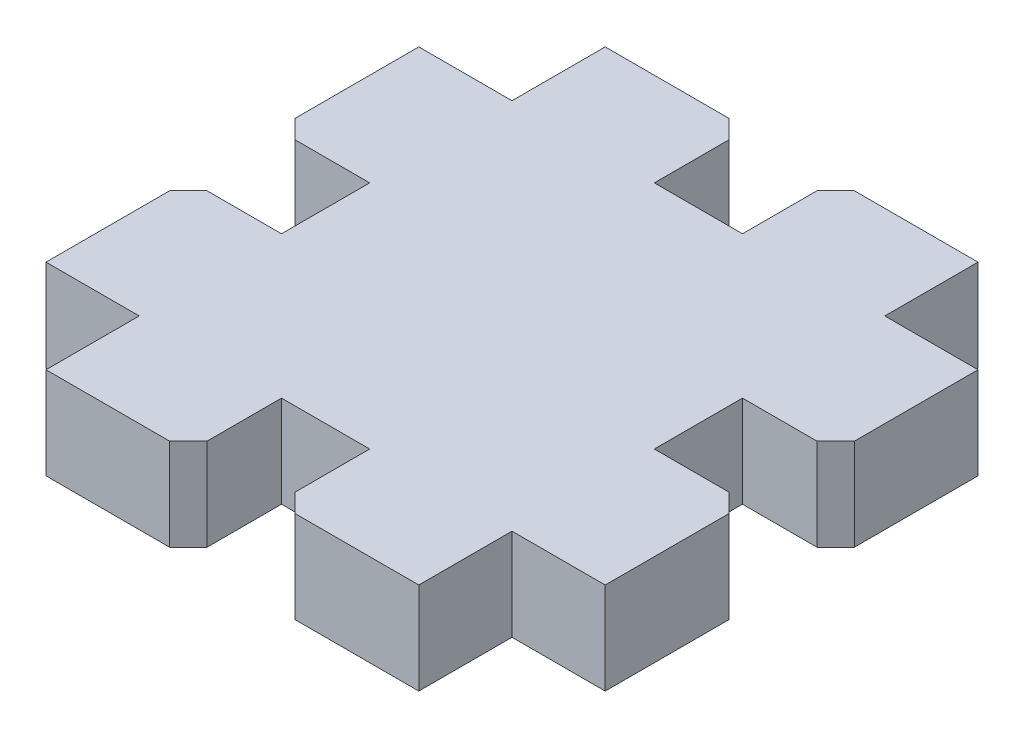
SolidWorks part; units mm, degrees
ref_plane "Front Plane" through (0, 0, 0) normal (0, 0, 1) x (1, 0, 0)
ref_plane "Top Plane" through (0, 0, 0) normal (0, 1, 0) x (1, 0, 0)
ref_plane "Right Plane" through (0, 0, 0) normal (1, 0, 0) x (0, 0, -1)
sketch "Sketch1" plane through (0, 0, 0) normal (0, 1, 0) x (1, 0, 0)
  line L0 (-3.0036, -11.2646) -> (-3.0036, -4.9146)
  line L1 (0, 0) -> (0, 21.9209) construction
  line L2 (-11.8657, 7.7854) -> (8.446, 7.7854) construction
  line L3 (0, 15.5709) -> (0, -6.35) construction
  line L4 (3.0036, 26.8354) -> (3.0036, 20.4854)
  line L5 (-3.0036, 20.4854) -> (3.0036, 20.4854)
  line L7 (-3.0036, 26.8354) -> (-3.0036, 20.4854)
  line L8 (12.7, 4.7819) -> (12.7, 10.789)
  line L9 (12.7, 10.789) -> (19.05, 10.789)
  line L11 (12.7, 4.7819) -> (19.05, 4.7819)
  line L12 (-12.7, 4.7819) -> (-19.05, 4.7819)
  line L14 (-12.7, 10.789) -> (-19.05, 10.789)
  line L16 (-12.7, 4.7819) -> (-12.7, 10.789)
  line L17 (-3.0036, -4.9146) -> (3.0036, -4.9146)
  line L18 (3.0036, -11.2646) -> (3.0036, -4.9146)
  line L19 (-12.7, 26.8354) -> (-3.0036, 26.8354)
  line L20 (-12.7, 26.8354) -> (-12.7, 20.4854)
  line L21 (-12.7, 20.4854) -> (-19.05, 20.4854)
  line L22 (-19.05, 20.4854) -> (-19.05, 10.789)
  line L23 (12.7, 26.8354) -> (3.0036, 26.8354)
  line L24 (12.7, 26.8354) -> (12.7, 20.4854)
  line L25 (12.7, 20.4854) -> (19.05, 20.4854)
  line L26 (19.05, 20.4854) -> (19.05, 10.789)
  line L27 (19.05, -4.9146) -> (19.05, 4.7819)
  line L28 (12.7, -4.9146) -> (19.05, -4.9146)
  line L29 (12.7, -11.2646) -> (12.7, -4.9146)
  line L30 (12.7, -11.2646) -> (3.0036, -11.2646)
  line L31 (-19.05, -4.9146) -> (-19.05, 4.7819)
  line L32 (-12.7, -4.9146) -> (-19.05, -4.9146)
  line L33 (-12.7, -11.2646) -> (-12.7, -4.9146)
  line L34 (-12.7, -11.2646) -> (-3.0036, -11.2646)
  point P3 (0, -4.9146)
  point P13 (0, 20.4854)
  point P22 (12.7, 7.7854)
  dimension "D1" = 12.7
  dimension "D3" = 9.6965
extrude "Boss-Extrude1" add sketch "Sketch1" along normal blind 6.2611
chamfer "Chamfer1" distance 1.27 angle 45 8 edges at (3.0036, 3.1305, -26.8354) (-3.0036, 3.1305, -26.8354) (19.05, 3.1305, -10.789) (19.05, 3.1305, -4.7819) (3.0036, 3.1305, 11.2646) (-3.0036, 3.1305, 11.2646) (-19.05, 3.1305, -4.7819) (-19.05, 3.1305, -10.789)
equation "\"slot_width\"=0.2465"
equation "\"slot_depth\"= 0.25    "
equation "\"half_slot_width\"= \"slot_width\" /2"
equation "\"2xslotdepth\"= \"slot_depth\"*2"
equation "\"press_fit_slot\"= \"slot_width\"-0.01"
